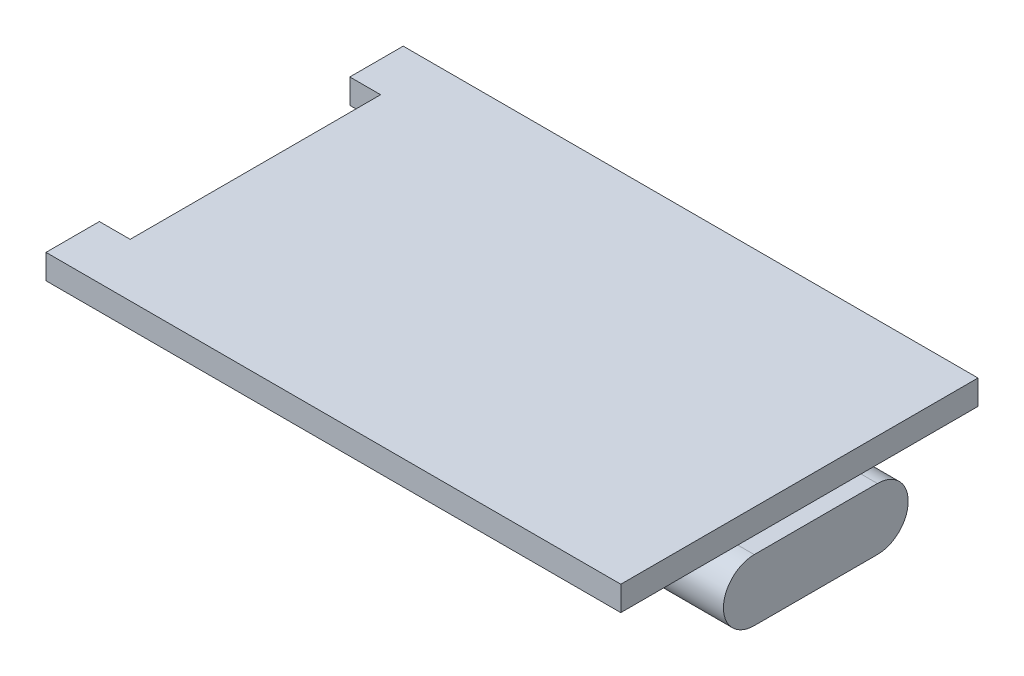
SolidWorks part; units mm, degrees
ref_plane "Plan de face" through (0, 0, 0) normal (0, 0, 1) x (1, 0, 0)
ref_plane "Plan de dessus" through (0, 0, 0) normal (0, 1, 0) x (1, 0, 0)
ref_plane "Plan de droite" through (0, 0, 0) normal (1, 0, 0) x (0, 0, -1)
sketch "Esquisse3" plane through (0, 0, 0) normal (1, 0, 0) x (0, 0, -1)
  line L0 (-3, 0) -> (3, 0) construction
  line L1 (-3, 1.5) -> (3, 1.5)
  line L2 (-3, -1.5) -> (3, -1.5)
  arc A0 (-3, 1.5) -> (-3, -1.5) centre (-3, 0) ccw
  arc A1 (3, -1.5) -> (3, 1.5) centre (3, 0) ccw
  point P2 (0, 0)
  dimension "D1" = 9
  dimension "D2" = 3
extrude "Boss.-Extru.1" add sketch "Esquisse3" against normal blind 6.8
sketch "Esquisse1" plane through (0, 1.5, 0) normal (0, 1, 0) x (1, 0, 0)
  line L0 (0, 3) -> (0, -3) construction
  line L1 (-28.8, 8.7) -> (-0.8, 8.7)
  line L2 (-28.8, 8.7) -> (-28.8, 6.1)
  line L3 (-28.8, -8.7) -> (-0.8, -8.7)
  line L4 (-0.8, 8.7) -> (-0.8, -8.7)
  line L5 (-28.8, 8.7) -> (-0.8, -8.7) construction
  line L6 (-28.8, -8.7) -> (-0.8, 8.7) construction
  line L10 (-28.8, -6.1) -> (-28.8, -8.7)
  line L11 (-28.8, 6.1) -> (-27.3, 6.1)
  line L12 (-28.8, -6.1) -> (-27.3, -6.1)
  line L13 (-27.3, 6.1) -> (-27.3, -6.1)
  point P0 (0, 0)
  point P6 (-27.3, 0)
  dimension "D1" = 28
  dimension "D2" = 17.4
  dimension "D3" = 1.5
  dimension "D4" = 2.6
  dimension "D5" = 0.8
extrude "Boss.-Extru.2" add sketch "Esquisse1" along normal blind 1.2
